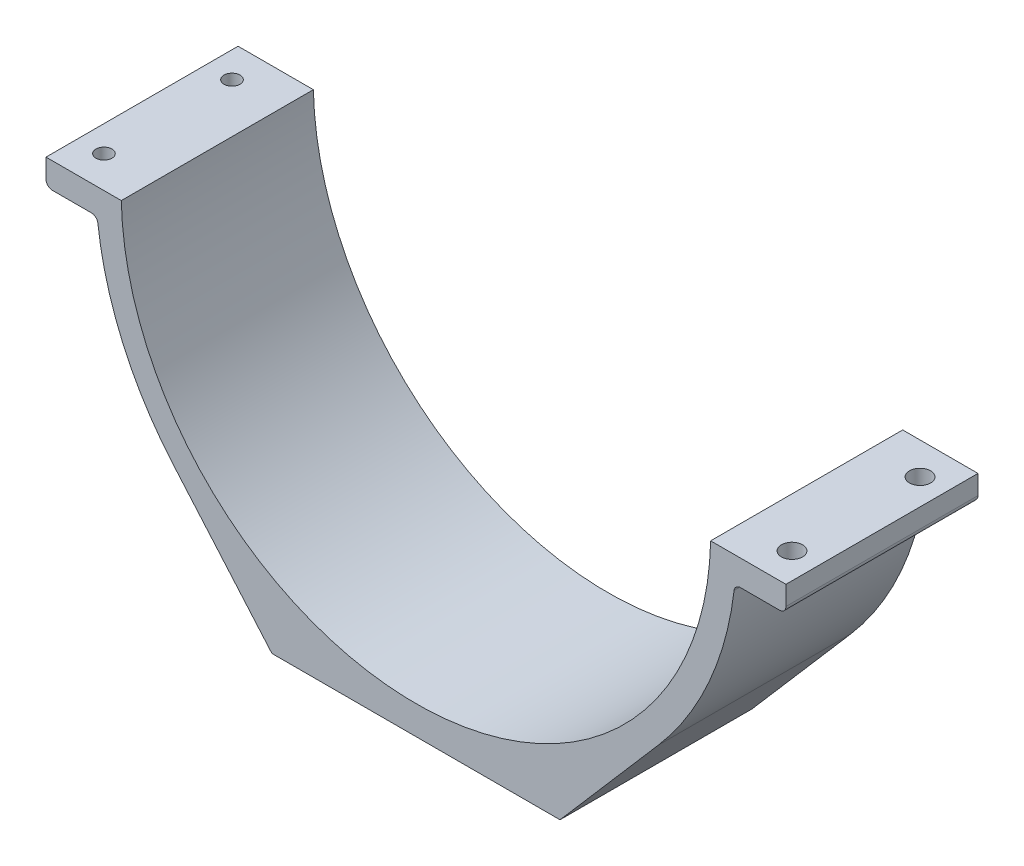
SolidWorks part; units mm, degrees
ref_plane "Front Plane" through (0, 0, 0) normal (0, 0, 1) x (1, 0, 0)
ref_plane "Top Plane" through (0, 0, 0) normal (0, 1, 0) x (1, 0, 0)
ref_plane "Right Plane" through (0, 0, 0) normal (1, 0, 0) x (0, 0, -1)
sketch "Sketch1" plane through (0, 0, 0) normal (0, 0, 1) x (1, 0, 0)
  line L0 (-57.7871, -1) -> (-46.0266, -1)
  line L1 (-44.45, 0) -> (49955.55, 0) construction
  line L2 (-57.7871, -1) -> (-57.7871, -4)
  line L3 (0, 44.45) -> (0, 35.9453) construction
  line L4 (22.5, -50.5) -> (-22.5, -50.5)
  line L5 (-56.7871, -5) -> (-50.6836, -5)
  line L6 (37.8679, -32.7074) -> (22.5, -50.5)
  line L7 (56.7871, -5) -> (50.6836, -5)
  line L8 (57.7871, -1) -> (57.7871, -4)
  line L9 (57.7871, -1) -> (46.0266, -1)
  line L10 (-37.8679, -32.7074) -> (-22.5, -50.5)
  circle A0 centre (0, 0) radius 46.0375 construction
  arc A1 (-46.0266, -1) -> (46.0266, -1) centre (0, 0) ccw construction
  arc A2 (-37.8679, -32.7074) -> (-49.6905, -5.8824) centre (0, 0) cw
  arc A3 (-57.7871, -4) -> (-56.7871, -5) centre (-56.7871, -4) ccw
  arc A4 (-46.0266, -1) -> (46.0266, -1) centre (0, 0) ccw
  arc A5 (57.7871, -4) -> (56.7871, -5) centre (56.7871, -4) cw
  arc A6 (37.8679, -32.7074) -> (49.6905, -5.8824) centre (0, 0) ccw
  arc A7 (49.6905, -5.8824) -> (50.6836, -5) centre (50.6836, -6) cw
  arc A8 (-49.6905, -5.8824) -> (-50.6836, -5) centre (-50.6836, -6) ccw
  point P16 (0, -50.5)
  point P23 (-57.7871, -5)
  point P26 (0, -50.5)
  point P27 (57.7871, -5)
  point P29 (0, -50.5)
  point P32 (-49.7871, -5)
  point P33 (49.7871, -5)
  point P36 (-49.7871, -5)
  point P37 (0, -46.0375)
  dimension "D1" = 49.5
  dimension "D2" = 92.075
  dimension "D6" = 1
  dimension "D7" = 1
  dimension "D3" = 4
  dimension "D9" = 1
  dimension "D5" = 4
  dimension "D4" = 22.5
  dimension "D8" = 8
extrude "Boss-Extrude1" add sketch "Sketch1" along normal blind 30
sketch "Sketch6" plane through (0, -5, 0) normal (0, -1, 0) x (1, 0, 0)
  line L0 (-53.7353, 30) -> (-53.7353, 0) construction
  line L2 (-56.7871, 30) -> (-50.6836, 30) construction
  line L3 (-56.7871, 0) -> (-50.6836, 0) construction
  point P8 (-53.7353, 25)
  point P12 (-53.7353, 5)
  dimension "D3" = 5
  dimension "D4" = 5
sketch "Sketch2" plane through (0, -50.5, 0) normal (0, -1, 0) x (1, 0, 0)
  line L0 (0, 0) -> (0, 50000) construction
  line L1 (-20, 5) -> (49980, 5) construction
  line L2 (-22.5, 0) -> (22.5, 0) construction
  line L3 (22.5, 30) -> (22.5, 0) construction
  line L4 (-17.3737, 25) -> (49982.6263, 25) construction
  line L5 (-22.5, 30) -> (22.5, 30) construction
  line L6 (-22.5, 30) -> (-22.5, 0) construction
  point P2 (-20, 5)
  point P5 (20, 5)
  point P16 (-20, 25)
  point P20 (20, 25)
  dimension "D1" = 2.5
  dimension "D2" = 5
  dimension "D3" = 2.5
  dimension "D4" = 5
hole_wizard "M3x0.5 Tapped Hole1" positions "3DSketch1" profile "Sketch7" tap size "M3x0.5" standard "ANSI Metric"
sketch3d "3DSketch1"
  point P3 (-53.7353, -5, 5)
  point P8 (-53.7353, -5, 25)
sketch "Sketch7" plane through (-53.7353, -5, 5) normal (1, 0, 0) x (0, 0, -1)
  line L0 (0, 0) -> (0, 4)
  line L1 (0, 4) -> (1.25, 4)
  line L2 (1.25, 4) -> (1.25, 0)
  line L5 (1.25, 0) -> (0, 0)
  line L11 (0, -6.35) -> (0, 107.95) construction
  dimension "Thru Tap Drill Dia." = 2.5
  dimension "Thru Tap Drill Depth" = 4
hole_wizard "M4x0.7 Tapped Hole1" positions "3DSketch2" profile "Sketch8" tap size "M4x0.7" standard "ANSI Metric"
sketch3d "3DSketch2"
  point P0 (-20, -50.5, 5)
  point P3 (20, -50.5, 5)
  point P6 (-20, -50.5, 25)
  point P9 (20, -50.5, 25)
sketch "Sketch8" plane through (-20, -50.5, 5) normal (1, 0, 0) x (0, 0, -1)
  line L0 (0, 0) -> (0, 8.4914)
  line L1 (0, 8.4914) -> (1.65, 7.5)
  line L2 (1.65, 7.5) -> (1.65, 0)
  line L5 (1.65, 0) -> (0, 0)
  line L10 (0, 8.4914) -> (-1.65, 7.5) construction
  line L11 (0, -6.35) -> (0, 107.95) construction
  dimension "Tap Drill Dia." = 3.3
  dimension "Tap Drill Depth" = 7.5
  dimension "Drill Angle" = 118
sketch "Sketch9" plane through (0, -5, 0) normal (0, -1, 0) x (1, 0, 0)
  line L0 (53.7353, 30) -> (53.7353, 0) construction
  line L1 (50.6836, 30) -> (56.7871, 30) construction
  line L2 (50.6836, 0) -> (56.7871, 0) construction
  line L3 (-200017.3737, 25) -> (249982.6263, 25) construction
  line L4 (-200020, 5) -> (249980, 5) construction
  circle A0 centre (53.7353, 25) radius 1.65
  circle A1 centre (53.7353, 5) radius 1.65
  dimension "D1" = 3.3
extrude "Cut-Extrude1" cut sketch "Sketch9" against normal through all
